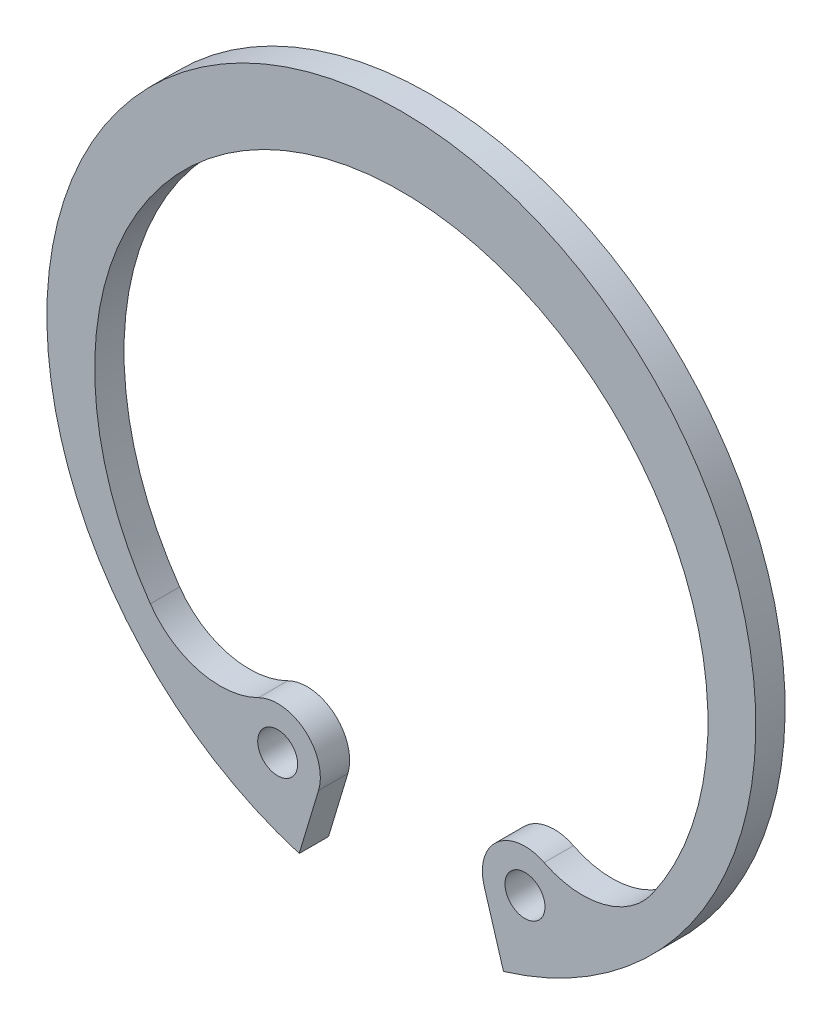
SolidWorks part; units mm, degrees
ref_plane "Plane1" through (0, 0, 0) normal (0, 0, 1) x (1, 0, 0)
ref_plane "Plane2" through (0, 0, 0) normal (0, 1, 0) x (1, 0, 0)
ref_plane "Plane3" through (0, 0, 0) normal (1, 0, 0) x (0, 0, -1)
sketch "Clipboard" plane through (0, 0, 0) normal (0, 0, 1) x (1, 0, 0)
  line L0 (0, 0) -> (2.6, 0)
  line L1 (0, 0) -> (0, 1.3)
  line L2 (0, 0) -> (0, -4)
  circle A0 centre (0, 0) radius 0.75
  circle A1 centre (0, 0) radius 12.5
  dimension "HoleDia" = 1.5
  dimension "BoreDia" = 25
  dimension "LargeSection" = 2.6
  dimension "SmallSection" = 1.3
  dimension "LugSection" = 4
sketch "BodySke" plane through (0, 0, 0) normal (0, 0, 1) x (1, 0, 0)
  line L0 (-1.5431, 0) -> (1.5431, 0) construction
  line L1 (0, 0) -> (0, 10.7) construction
  line L2 (3.8326, -12.7358) -> (3.107, -10.3246)
  line L3 (-3.8326, -12.7358) -> (-3.107, -10.3246)
  line L4 (0, 0) -> (10.2831, -8.4349) construction
  line L5 (0, 0) -> (-10.2831, -8.4349) construction
  line L6 (-4.423, -9.1453) -> (-4.8552, -10.5817) construction
  line L7 (4.4228, -9.1448) -> (4.8554, -10.5823) construction
  arc A0 (-3.107, -10.3246) -> (-5.359, -8.4346) centre (-4.6391, -9.8635) ccw
  arc A1 (5.359, -8.4346) -> (3.107, -10.3246) centre (4.6391, -9.8635) ccw
  arc A2 (9.278, -7.6104) -> (-9.278, -7.6104) centre (0, -0.8058) ccw construction
  arc A3 (3.8326, -12.7358) -> (-3.8326, -12.7358) centre (0, 0) ccw
  circle A4 centre (4.6391, -9.8635) radius 0.75
  circle A5 centre (-4.6391, -9.8635) radius 0.75
  arc A7 (9.4182, -7.415) -> (-9.4182, -7.415) centre (0, -0.8058) ccw
  arc A8 (-4.6391, -9.8635) -> (4.6391, -9.8635) centre (0, 0) ccw construction
  arc A9 (-9.4182, -7.415) -> (-5.359, -8.4346) centre (-6.7988, -5.5768) ccw
  arc A10 (5.359, -8.4346) -> (9.4182, -7.415) centre (6.7988, -5.5768) ccw
  dimension "GrooveDia" = 26.6
  dimension "TipRad" = 1.6
  dimension "HoleOffsetRad" = 10.9
  dimension "HoleDia" = 1.5
  dimension "FilletRad" = 3.2
  dimension "LargeRad" = 10.7
  dimension "SmallRad" = 12
  dimension "SmallAngle" = 101.278
  dimension "GapAngle" = 33.496
extrude "Body" add sketch "BodySke" against normal blind 1.1
sketch "ModLugSke" plane through (0, 0, 0) normal (0, 0, 1) x (1, 0, 0)
  line L0 (3.8326, -12.7358) -> (2.888, -9.5969)
  line L1 (-3.8326, -12.7358) -> (-2.888, -9.5969)
  line L2 (7.1797, -5.9112) -> (10.2677, -8.4537) construction
  line L3 (-7.1797, -5.9112) -> (-10.2677, -8.4537) construction
  line L4 (-3.8326, -12.7358) -> (-3.107, -10.3246) construction
  line L5 (3.107, -10.3246) -> (3.8326, -12.7358) construction
  line L6 (0, 0) -> (0, -12.7358) construction
  line L7 (9.261, -7.6249) -> (10.2677, -8.4537)
  line L8 (-10.2677, -8.4537) -> (-9.261, -7.6249)
  arc A0 (3.8326, -12.7358) -> (10.2677, -8.4537) centre (0, 0) ccw
  arc A1 (-4.72, -8.0132) -> (-3.337, -8.6807) centre (0, 0) ccw
  arc A2 (3.8326, -12.7358) -> (-3.8326, -12.7358) centre (0, 0) ccw construction
  arc A3 (5.359, -8.4346) -> (3.107, -10.3246) centre (4.6391, -9.8635) ccw construction
  arc A4 (-4.72, -8.0132) -> (-5.5531, -8.0613) centre (-5.1006, -8.6595) ccw
  arc A5 (-9.261, -7.6249) -> (-5.5531, -8.0613) centre (-7.1797, -5.9112) ccw
  arc A6 (9.4182, -7.415) -> (-9.4182, -7.415) centre (0, -0.8058) ccw construction
  arc A7 (5.5531, -8.0613) -> (9.261, -7.6249) centre (7.1797, -5.9112) ccw
  arc A8 (3.337, -8.6807) -> (4.72, -8.0132) centre (0, 0) ccw
  arc A9 (-10.2677, -8.4537) -> (-3.8326, -12.7358) centre (0, 0) ccw
  circle A10 centre (-4.6391, -9.8635) radius 0.75
  circle A11 centre (-4.6391, -9.8635) radius 0.75 construction
  circle A12 centre (4.6391, -9.8635) radius 0.75
  circle A13 centre (4.6391, -9.8635) radius 0.75 construction
  arc A14 (-3.337, -8.6807) -> (-2.888, -9.5969) centre (-3.6062, -9.3807) cw
  arc A15 (3.337, -8.6807) -> (2.888, -9.5969) centre (3.6062, -9.3807) ccw
  arc A16 (4.72, -8.0132) -> (5.5531, -8.0613) centre (5.1006, -8.6595) cw
  point P43 (2.6799, -8.9055)
  dimension "LugAng" = 60.998
extrude "ModLug" [suppressed] add sketch "ModLugSke" against normal through all
equation "' \"BoreDia@Clipboard\" = 8"
equation "' \"Thickness@Body\" = 0.4"
equation "' \"GrooveDia@BodySke\" = 8.4"
equation "' \"LugSection@Clipboard\" = 1.7"
equation "' \"LargeSection@Clipboard\" = 0.85"
equation "' \"SmallSection@Clipboard\" = 0.45"
equation "' \"HoleDia@Clipboard\" = 0.8"
equation "' \"BoreDia@Clipboard\" = 25"
equation "' \"Thickness@Body\" = 1.1"
equation "' \"GrooveDia@BodySke\" = 26.6"
equation "' \"LugSection@Clipboard\" = 4"
equation "' \"LargeSection@Clipboard\" = 2.6"
equation "' \"SmallSection@Clipboard\" = 1.3"
equation "' \"HoleDia@Clipboard\" = 1.5"
equation "\"TipRad@BodySke\" = (\"LugSection@Clipboard\" - (\"GrooveDia@BodySke\" / 2  -  \"BoreDia@Clipboard\" / 2 ) ) / 2"
equation "\"HoleOffsetRad@BodySke\" = (\"GrooveDia@BodySke\" / 2) - \"LugSection@Clipboard\"  + \"TipRad@BodySke\""
equation "\"LargeRad@BodySke\" =  \"GrooveDia@BodySke\" / 2 -  \"LargeSection@Clipboard\""
equation "\"SmallRad@BodySke\" =  \"GrooveDia@BodySke\" / 2 -  \"SmallSection@Clipboard\""
equation "\"HoleDia@BodySke\" =  \"HoleDia@Clipboard\""
equation "\"FilletRad@BodySke\" = \"TipRad@BodySke\" * 2"
equation "\"GapAngle@BodySke\" = 360 - 0.965 * 360 * ( \"BoreDia@Clipboard\" /  \"GrooveDia@BodySke\")"
equation "\"LugAng@ModLugSke\" = \"GapAngle@BodySke\"  + 1.5 * 360 * (\"LugSection@Clipboard\" / (\"BoreDia@Clipboard\" * 3.1416))"
